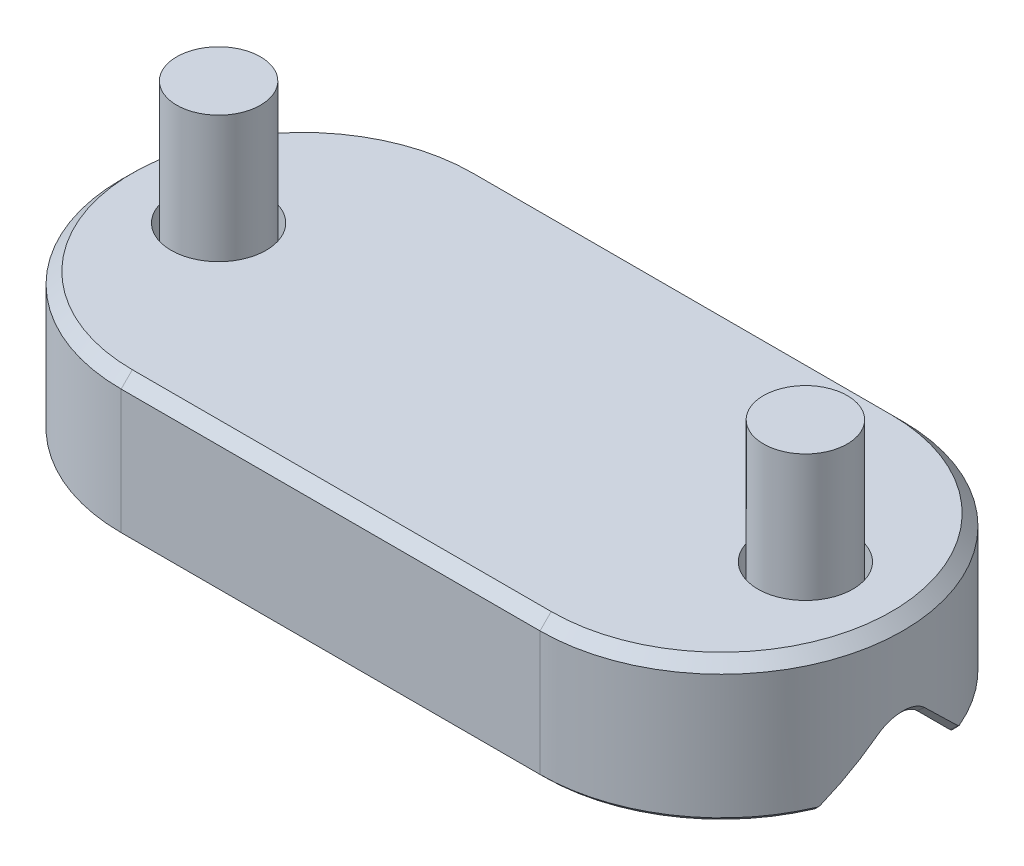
SolidWorks part; units mm, degrees
other "<LHCSM6-1L12>-<HEX>"
ref_plane "Front Plane" through (0, 0, 0) normal (0, 0, 1) x (1, 0, 0)
ref_plane "Top Plane" through (0, 0, 0) normal (0, 1, 0) x (1, 0, 0)
ref_plane "Right Plane" through (0, 0, 0) normal (1, 0, 0) x (0, 0, -1)
sketch "Sketch1" plane through (0, 0, 0) normal (0, 1, 0) x (1, 0, 0)
  line L0 (0, 6.99) -> (0, -6.99) construction
  line L1 (-14.99, 12.985) -> (14.99, 12.985)
  line L3 (-14.99, -12.985) -> (14.99, -12.985)
  line L5 (-9.5545, 0) -> (8.6705, 0) construction
  arc A0 (-14.99, 12.985) -> (-14.99, -12.985) centre (-14.99, 0) ccw
  arc A1 (14.99, -12.985) -> (14.99, 12.985) centre (14.99, 0) ccw
  circle A2 centre (-21, 0) radius 3.4
  circle A3 centre (21, 0) radius 3.4
  dimension "D3" = 42
  dimension "D1" = 55.95
  dimension "D4" = 6.8
  dimension "D2" = 25.97
extrude "Boss-Extrude1" add sketch "Sketch1" along normal blind 10
sketch "Sketch3" plane through (0, 0, 0) normal (0, 1, 0) x (1, 0, 0)
  circle A0 centre (-21, 0) radius 5.625
  circle A1 centre (21, 0) radius 5.625
  dimension "D1" = 11.25
extrude "Cut-Extrude1" cut sketch "Sketch3" along normal blind 6.8
sketch "Sketch4" plane through (0, 0, 0) normal (-1, 0, 0) x (0, 0, -1)
  line L0 (-4.7654, 0) -> (-1.4142, -3.3512)
  line L1 (1.4142, -3.3512) -> (4.7654, 0)
  line L2 (0, -0.0283) -> (0, -10) construction
  line L3 (0, -6.8) -> (0, -10) construction
  line L4 (12.985, 0) -> (-12.985, 0) construction
  line L5 (-12.985, -10) -> (12.985, -10) construction
  line L6 (-4.7654, 0) -> (4.7654, 0)
  arc A4 (-1.4142, -3.3512) -> (1.4142, -3.3512) centre (0, -1.937) ccw
  dimension "D1" = 2
  dimension "D3" = 3.937
  dimension "D2" = 90
extrude "Cut-Extrude2" cut sketch "Sketch4" against normal through all both and the other way through all
fillet "Fillet1" radius 0.5 6 edges at (-25.5287, 0, -4.7654) (-25.5287, 0, 4.7654) (25.5287, 0, 4.7654) (0, 0, 4.7654) (25.5287, 0, -4.7654) (0, 0, -4.7654)
chamfer "Chamfer1" distance 0.3 angle 45 16 edges at (27.6138, 1.7242, 3.0412) (-27.6138, 1.7242, 3.0412) (27.6138, 1.7242, -3.0412) (-27.6138, 1.7242, -3.0412) (27.9731, 3.9247, 0.2215) (-27.9731, 3.9247, -0.2215) (0, 0, -12.985) (-22.2026, 0, -10.7977) (22.2026, 0, -10.7977) (-27.0562, 0.0316, -4.7976) (27.0707, 0.0469, -4.7611) (-27.0707, 0.0469, 4.7611) (27.0562, 0.0316, 4.7976) (-22.2026, 0, 10.7977) (22.2026, 0, 10.7977) (0, 0, 12.985)
chamfer "Chamfer2" distance 0.8 angle 45 4 edges at (0, 10, -12.985) (-27.975, 10, 0) (27.975, 10, 0) (0, 10, 12.985)
inserted part "LHCSM6-1L12"
move or copy body "Body-Move/Copy4" placed by mates yes parameters "D1"=0, "D2"=0, "D3"=0
mirror "Mirror1" about plane through (0, 0, 0) normal (1, 0, 0)
